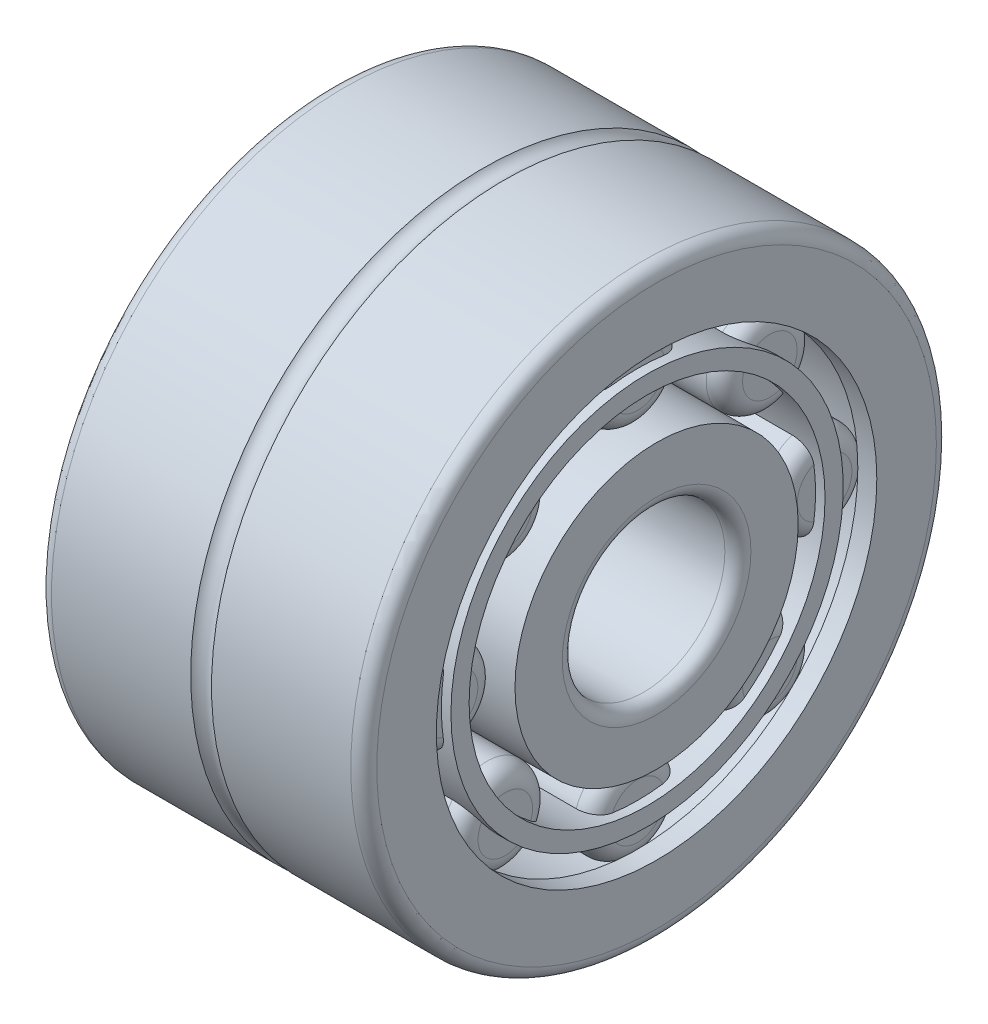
SolidWorks part; units mm, degrees
ref_plane "Plane1" through (0, 0, 0) normal (0, 0, 1) x (1, 0, 0)
ref_plane "Plane2" through (0, 0, 0) normal (0, 1, 0) x (1, 0, 0)
ref_plane "Plane3" through (0, 0, 0) normal (1, 0, 0) x (0, 0, -1)
sketch "Clipboard" plane through (0, 0, 0) normal (0, 0, 1) x (1, 0, 0)
  line L0 (-10, 0) -> (10, 0) construction
  line L1 (0, 0) -> (27.3694, -3.8465)
  line L2 (0, 0) -> (36.1572, 5.0816)
  line L3 (0, 0) -> (44.9449, -6.3166)
  line L4 (0, 0) -> (-22.3471, -0.7804)
  dimension "CLdia" = 36.5125
  dimension "Count" = 8
  dimension "Show_count" = 8
  dimension "Max_count" = 8
  dimension "Min_count" = 2
  dimension "Race_OD" = 45.3866
  dimension "Race_ID" = 27.6384
sketch "OutRacSke" plane through (0, 0, 0) normal (0, 0, 1) x (1, 0, 0)
  line L0 (-14.0229, 22.6933) -> (-14.0229, 21.4933)
  line L1 (-14.0229, 21.4933) -> (-15.875, 21.4933)
  line L2 (-15.875, 21.4933) -> (-15.875, 27.305)
  line L3 (-14.605, 28.575) -> (-1.016, 28.575)
  line L4 (15.875, 27.305) -> (15.875, 21.4933)
  line L5 (15.875, 21.4933) -> (14.0229, 21.4933)
  line L6 (14.0229, 21.4933) -> (14.0229, 22.6933)
  line L7 (14.0229, 22.6933) -> (-14.0229, 22.6933)
  line L8 (-7.9375, 0) -> (7.9375, 0) construction
  line L9 (1.016, 28.575) -> (14.605, 28.575)
  arc A0 (-15.875, 27.305) -> (-14.605, 28.575) centre (-14.605, 27.305) cw
  arc A1 (14.605, 28.575) -> (15.875, 27.305) centre (14.605, 27.305) cw
  arc A2 (-1.016, 28.575) -> (1.016, 28.575) centre (0, 29.337) ccw
  dimension "Radius" = 1.27
  dimension "D1" = 14.0229
  dimension "Race_OD" = 45.3866
  dimension "D2" = 0.762
  dimension "OD" = 57.15
  dimension "Cyl_Len" = 28.0458
  dimension "Width" = 31.75
  dimension "Groove_Dp" = 1.2
  dimension "halfWidth" = 15.875
revolve "OuterRace" add sketch "OutRacSke" angle 360 about L8
sketch "RolDetSke" plane through (0, 0, 0) normal (0, 0, 1) x (1, 0, 0)
  line L0 (-14.0229, 20.9188) -> (-14.0229, 18.2562)
  line L1 (-14.0229, 18.2562) -> (14.0229, 18.2562)
  line L2 (14.0229, 18.2562) -> (14.0229, 20.9188)
  line L3 (12.2479, 22.6938) -> (-12.2479, 22.6938)
  line L4 (-28.575, 18.2562) -> (28.575, 18.2562) construction
  arc A0 (14.0229, 20.9188) -> (12.2479, 22.6938) centre (12.2479, 20.9188) ccw
  arc A1 (-12.2479, 22.6938) -> (-14.0229, 20.9188) centre (-12.2479, 20.9188) ccw
  dimension "radius" = 1.775
  dimension "CLRad" = 18.2562
  dimension "Roller_diameter" = 8.8751
  dimension "Cyl_Len" = 28.0458
  dimension "halfCylLen" = 14.0229
revolve "RollerDetailed" add sketch "RolDetSke" angle 360 about L4
ref_axis "Axis1" through (-50, 0, 0) along (1, 0, 0)
sketch "RolSimSke" plane through (0, 25.4, 0) normal (0, 0, 1) x (1, 0, 0)
  line L0 (-14.0229, -4.4807) -> (-14.0229, -9.8058)
  line L1 (-25.4, -25.4) -> (25.4, -25.4) construction
  line L2 (14.0229, -9.8058) -> (14.0229, -4.4807)
  line L3 (12.2479, -2.7057) -> (-12.2479, -2.7057)
  line L5 (12.2479, -11.5808) -> (-12.2479, -11.5808)
  arc A0 (14.0229, -4.4807) -> (12.2479, -2.7057) centre (12.2479, -4.4807) ccw
  arc A1 (-12.2479, -2.7057) -> (-14.0229, -4.4807) centre (-12.2479, -4.4807) ccw
  arc A2 (14.0229, -9.8058) -> (12.2479, -11.5808) centre (12.2479, -9.8058) cw
  arc A3 (-12.2479, -11.5808) -> (-14.0229, -9.8058) centre (-12.2479, -9.8058) cw
  dimension "radius" = 1.775
  dimension "Bore" = 27.6384
  dimension "Roller_diameter" = 8.8751
  dimension "Cyl_Len" = 28.0458
  dimension "halfLength" = 14.0229
revolve "RollersSimplified" [suppressed] add sketch "RolSimSke" angle 360 about L1
sketch "InsRacSke" plane through (0, 0, 0) normal (0, 0, 1) x (1, 0, 0)
  line L2 (-15.875, 13.8192) -> (-15.875, 9.2075)
  line L4 (-14.605, 7.9375) -> (14.605, 7.9375)
  line L5 (15.875, 9.2075) -> (15.875, 13.8192)
  line L8 (15.875, 13.8192) -> (-15.875, 13.8192)
  line L9 (-7.9375, 0) -> (7.9375, 0) construction
  arc A0 (-15.875, 9.2075) -> (-14.605, 7.9375) centre (-14.605, 9.2075) ccw
  arc A2 (14.605, 7.9375) -> (15.875, 9.2075) centre (14.605, 9.2075) ccw
  dimension "radius" = 1.27
  dimension "Bore" = 15.875
  dimension "Width_IR" = 31.75
  dimension "halfWidth" = 15.875
  dimension "Race_ID" = 27.6384
revolve "InnerRace" add sketch "InsRacSke" angle 360 about L9
sketch "CagSpiSke" plane through (0, 0, 0) normal (0, 0, 1) x (1, 0, 0)
  line L0 (-17.1595, 0) -> (17.1595, 0) construction
  line L3 (-14.949, 17.3687) -> (14.949, 17.3687)
  line L4 (-14.949, 17.3687) -> (-14.949, 19.1438)
  line L5 (-14.949, 19.1438) -> (14.949, 19.1438)
  line L6 (14.949, 17.3687) -> (14.949, 19.1438)
  dimension "d2" = 34.7375
  dimension "cage_width" = 29.8979
  dimension "halfwidth" = 14.949
  dimension "cage_thickness" = 1.775
revolve "CageSpine" add sketch "CagSpiSke" angle 360 about L0
pattern_circular "RollersDetailed" count 8 every 45 about axis through (-50, 0, 0) along (1, 0, 0) of "RollerDetailed"
equation "\"halfWidth@OutRacSke\" =  \"Width@OutRacSke\" / 2"
equation "\"CLdia@Clipboard\" =  ( \"Race_OD@Clipboard\" + \"Race_ID@Clipboard\" )  / 2"
equation "\"CLRad@RolDetSke\" = ( \"Race_OD@Clipboard\" + \"Race_ID@Clipboard\" )  / 4"
equation "\"Roller_diameter@RolDetSke\" =  ( \"Race_OD@Clipboard\" -  \"Race_ID@Clipboard\" )  / 2 + .001"
equation "\"Roller_diameter@RolSimSke\" = ( \"Race_OD@Clipboard\" -  \"Race_ID@Clipboard\" )  / 2 + .001"
equation "\"radius@RolDetSke\" = \"Roller_diameter@RolDetSke\" / 5"
equation "\"radius@RolSimSke\" = \"Roller_diameter@RolSimSke\" / 5"
equation "\"Cyl_Len@OutRacSke\" = \"Cyl_Len@RolDetSke\""
equation "\"Cyl_Len@RolSimSke\" = \"Cyl_Len@RolDetSke\""
equation "\"halfCylLen@RolDetSke\" = \"Cyl_Len@RolDetSke\" / 2"
equation "\"D1@OutRacSke\" = \"Cyl_Len@OutRacSke\" / 2"
equation "\"D2@OutRacSke\" = \"Radius@OutRacSke\" * .6"
equation "\"Cage_width@CagSpiSke\" =  ( \"Cyl_Len@RolDetSke\" + \"Width@OutRacSke\" )  / 2"
equation "\"halfWidth@CagSpiSke\" = \"Cage_width@CagSpiSke\" / 2"
equation "\"Cage_thickness@CagSpiSke\"  = \"Roller_diameter@RolDetSke\" / 5"
equation "\"D2@CagSpiSke\" =  \"CLRad@RolDetSke\" * 2 - \"Cage_thickness@CagSpiSke\""
equation "\"Max_count@Clipboard\" = int( 3.14159265 / atn(( \"Roller_diameter@RolDetSke\" / 2) / sqr( \"CLRad@RolDetSke\"  *  \"CLRad@RolDetSke\" - ( \"Roller_diameter@RolDetSke\" / 2) *  ( \"Roller_diameter@RolDetSke\" / "
equation "\"Max_count@Clipboard\" = ((sgn( \"Max_count@Clipboard\" - \"Count@Clipboard\" )-1)*( \"Max_count@Clipboard\" - \"Count@Clipboard\" ))/-2+ \"Count@Clipboard\""
equation "\"Count@RollersDetailed\" = int( \"Show_count@Clipboard\" ) "
equation "\"Count@RollersDetailed\" = ((sgn( \"Count@RollersDetailed\" - \"Max_count@Clipboard\" )-1)*( \"Count@RollersDetailed\" - \"Max_count@Clipboard\" ))/-2+ \"Max_count@Clipboard\""
equation "\"Count@RollersDetailed\" = ((sgn( \"Count@RollersDetailed\" - \"Min_count@Clipboard\" )+1)*( \"Count@RollersDetailed\" - \"Min_count@Clipboard\"))/2 +\"Min_count@Clipboard\""
equation "\"Angle@RollersDetailed\" = 360.0 / \"Max_count@Clipboard\""
equation "\"Bore@RolSimSke\" = \"Race_ID@Clipboard\""
equation "\"Race_ID@InsRacSke\" = \"Race_ID@Clipboard\""
equation "\"halfWidth@InsRacSke\" = \"Width_IR@InsRacSke\" / 2"
equation "\"halfLength@RolSimSke\" = \"Cyl_Len@RolSimSke\" / 2"
equation "\"Race_OD@OutRacSke\" = \"Race_OD@Clipboard\""
equation "\"Width_IR@InsRacSke\" = \"Width@OutRacSke\""
equation "\"Angle@CageSpine\" =  \"Angle@RollersDetailed\" * ( \"Count@RollersDetailed\" -1 + int( \"Count@RollersDetailed\" / \"Max_count@Clipboard\" ) )  + 0.001 -  int( \"Count@RollersDetailed\" / \"Max_count@Clipboard\" "
equation "\"Angle@CageSpine\" =  \"Angle@CageSpine\" * int( \"Min_count@Clipboard\" / 2) + int(1 / \"Min_count@Clipboard\")  * 0.001"
equation "\"radius@InsRacSke\" = \"Radius@OutRacSke\""
